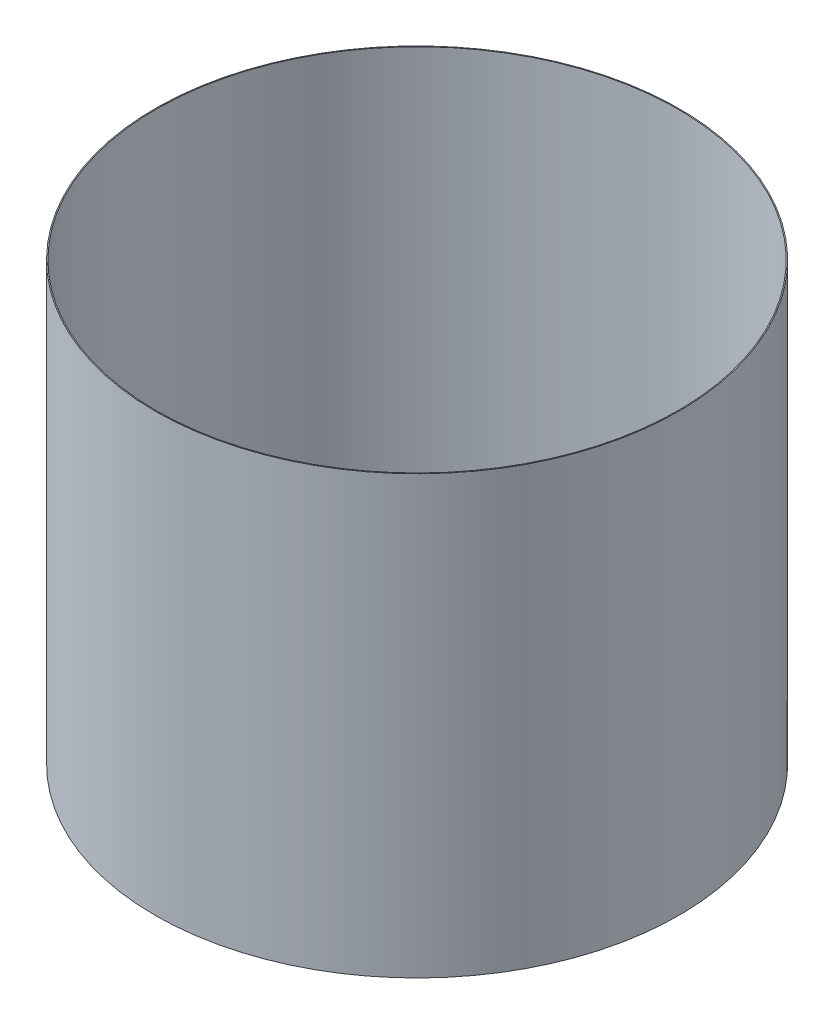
SolidWorks part; units mm, degrees
ref_plane "Front Plane" through (0, 0, 0) normal (0, 0, 1) x (1, 0, 0)
ref_plane "Top Plane" through (0, 0, 0) normal (0, 1, 0) x (1, 0, 0)
ref_plane "Right Plane" through (0, 0, 0) normal (1, 0, 0) x (0, 0, -1)
sketch "Sketch1" plane through (0, 0, 0) normal (0, 1, 0) x (1, 0, 0)
  circle A0 centre (0, 0) radius 33
  dimension "D1" = 66
extrude "Boss-Extrude1" add sketch "Sketch1" along normal blind 55
shell "Shell1" thickness 0.12
